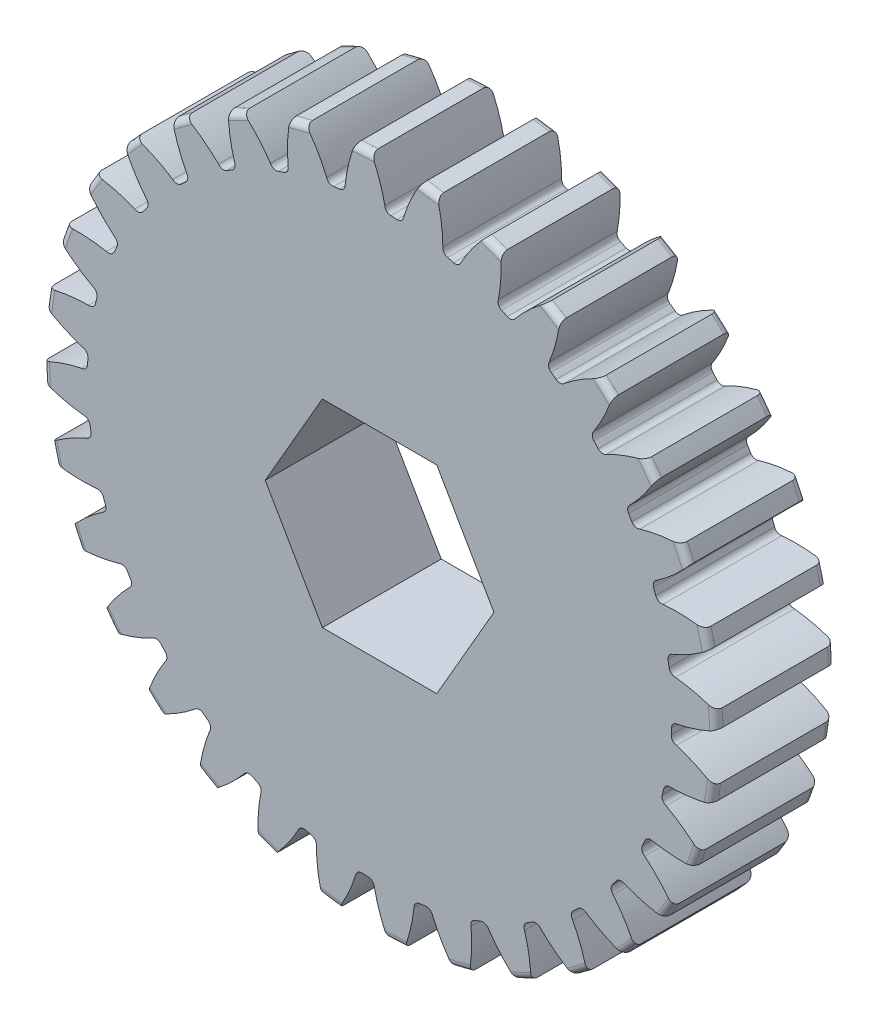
SolidWorks part; units mm, degrees
ref_plane "Front" through (0, 0, 0) normal (0, 0, 1) x (1, 0, 0)
ref_plane "Top" through (0, 0, 0) normal (0, 1, 0) x (1, 0, 0)
ref_plane "Right" through (0, 0, 0) normal (1, 0, 0) x (0, 0, -1)
sketch "Sketch1" plane through (0, 0, 0) normal (0, 0, 1) x (1, 0, 0)
  line L0 (-406.4, 0) -> (406.4, 0) construction
  circle A0 centre (0, 0) radius 13.4938
  circle A1 centre (0, 0) radius 12.7 construction
  circle A3 centre (0, 0) radius 11.7078 construction
extrude "Boss-Extrude1" add sketch "Sketch1" against normal blind 4.7625
sketch "Sketch2" plane through (0, 0, 0) normal (1, 0, 0) x (0, 0, -1)
  line L0 (4.7625, 0) -> (11.0998, 0)
  line L1 (4.7625, 0) -> (4.7625, 6.35)
  line L2 (4.7625, 6.35) -> (11.0998, 6.35)
  line L3 (11.0998, 6.35) -> (11.0998, 0)
  point P5 (11.0998, -6.35)
  point P6 (0, -13.4937)
  point P7 (4.7625, -13.4937)
  point P9 (0, 13.4937)
fillet "Fillet2" radius 0.2699 2 edges at (13.4937, 0, -4.7625) (13.4937, 0, 0)
sketch "Sketch3" plane through (0, 0, 0) normal (0, 0, 1) x (1, 0, 0)
  line L0 (0, 0) -> (0, 13.4937) construction
  line L1 (-4.0817, 11.2144) -> (0, 12.7)
  line L2 (-9.5921, 12.7) -> (9.5921, 12.7) construction
  line L3 (-9.0136, 9.4193) -> (9.0136, 15.9807) construction
  line L4 (-4.0817, 11.2144) -> (0, 0) construction
  line L5 (-9.8295, 6.7678) -> (0, 0) construction
  line L6 (-9.8295, 6.7678) -> (-3.193, 16.4066) construction
  line L7 (-2.8353, 11.5924) -> (0, 0) construction
  line L8 (-2.8353, 11.5924) -> (0.1182, 12.3148) construction
  arc A0 (-4.0817, 11.2144) -> (-9.8295, 6.7678) centre (0, 0) ccw
  circle A1 centre (0, 0) radius 12.7 construction
  circle A2 centre (0, 0) radius 11.9341 construction
  arc A3 (-4.0817, 11.2144) -> (-2.8353, 11.5924) centre (0, 0) cw
  circle A4 centre (0, 0) radius 13.4937 construction
  point P6 (0, 12.7)
sketch "Sketch4" plane through (0, 0, 0) normal (0, 0, 1) x (1, 0, 0)
  line L0 (0, 0) -> (0.6224, 12.6694) construction
  line L1 (0.2102, 11.9322) -> (0.2102, 11.7059)
  line L2 (0, 12.7) -> (1.2448, 12.6388) construction
  line L3 (0.9604, 11.8954) -> (0.9382, 11.6702)
  line L4 (0.2102, 11.7059) -> (0, 0) construction
  line L5 (0, 0) -> (0, 13.4937) construction
  line L6 (-9.8295, 6.7678) -> (-3.193, 16.4066) construction
  line L7 (-9.8295, 6.7678) -> (-3.193, 16.4066) construction
  arc A0 (0.9382, 11.6702) -> (0.2102, 11.7059) centre (0, 0) ccw
  arc A1 (0, 12.7) -> (1.2448, 12.6388) centre (0, 0) cw construction
  circle A2 centre (0, 0) radius 12.7 construction
  circle A3 centre (0, 0) radius 11.9341 construction
  circle A4 centre (0, 0) radius 11.7078 construction
  arc A5 (4.7858, 16.0146) -> (-3.193, 16.4066) centre (0, 0) ccw
  spline S0 degree 2 poles (-3.193, 16.4066) (-0.3735, 14.7207) (0.2102, 11.9322) knots 0 0 0 1 1 1
  spline S1 degree 2 poles (4.7858, 16.0146) (1.8146, 14.6132) (0.9604, 11.8954) knots 0 0 0 1 1 1
extrude "Cut-Extrude1" cut sketch "Sketch4" against normal through all
fillet "Fillet1" radius 0.2494 2 edges at (0.9382, 11.6702, -2.3813) (0.2102, 11.7059, -2.3813)
pattern_circular "CirPattern1" count 32 over 360 about axis through (0, 0, -4.7625) along (0, 0, 1) of "Cut-Extrude1", "Fillet1"
sketch "Pitch Dia" plane through (0, 0, 0) normal (0, 0, 1) x (1, 0, 0)
  circle A0 centre (0, 0) radius 12.7 construction
  circle A1 centre (0, 0) radius 12.7 construction
sketch "Sketch5" plane through (0, 0, 0) normal (0, 0, 1) x (1, 0, 0)
  line L1 (4.5827, 0) -> (2.2914, 3.9688)
  line L2 (2.2914, 3.9688) -> (-2.2914, 3.9688)
  line L3 (-2.2914, 3.9688) -> (-4.5827, 0)
  line L4 (-4.5827, 0) -> (-2.2914, -3.9687)
  line L5 (-2.2914, -3.9687) -> (2.2914, -3.9687)
  line L7 (2.2914, -3.9687) -> (4.5827, 0)
  circle A0 centre (0, 0) radius 3.9688 construction
  dimension "D1" = 7.9375
extrude "Cut-Extrude2" cut sketch "Sketch5" against normal through all
equation "\"D1@Boss-Extrude1\" = \"Face Wd@Sketch2\""
equation "\"D2@Sketch3\" = \"D1@Sketch3\"*1.7"
equation "\"D3@Sketch3\" = \"D1@Sketch3\"+\"D2@Sketch3\"-.001"
equation "\"D4@Sketch3\" = \"D1@Sketch3\"*.3"
equation "\"D5@Sketch3\" = \"D1@Sketch3\"-\"D4@Sketch3\""
equation "\"D1@Sketch4\" = 1.5708/(\"Number of Teeth@Sketch1\"/\"Ptich Dia@Sketch1\")"
equation "\"D1@Sketch1\" = 2.250/(\"Number of Teeth@Sketch1\"/\"Ptich Dia@Sketch1\")"
